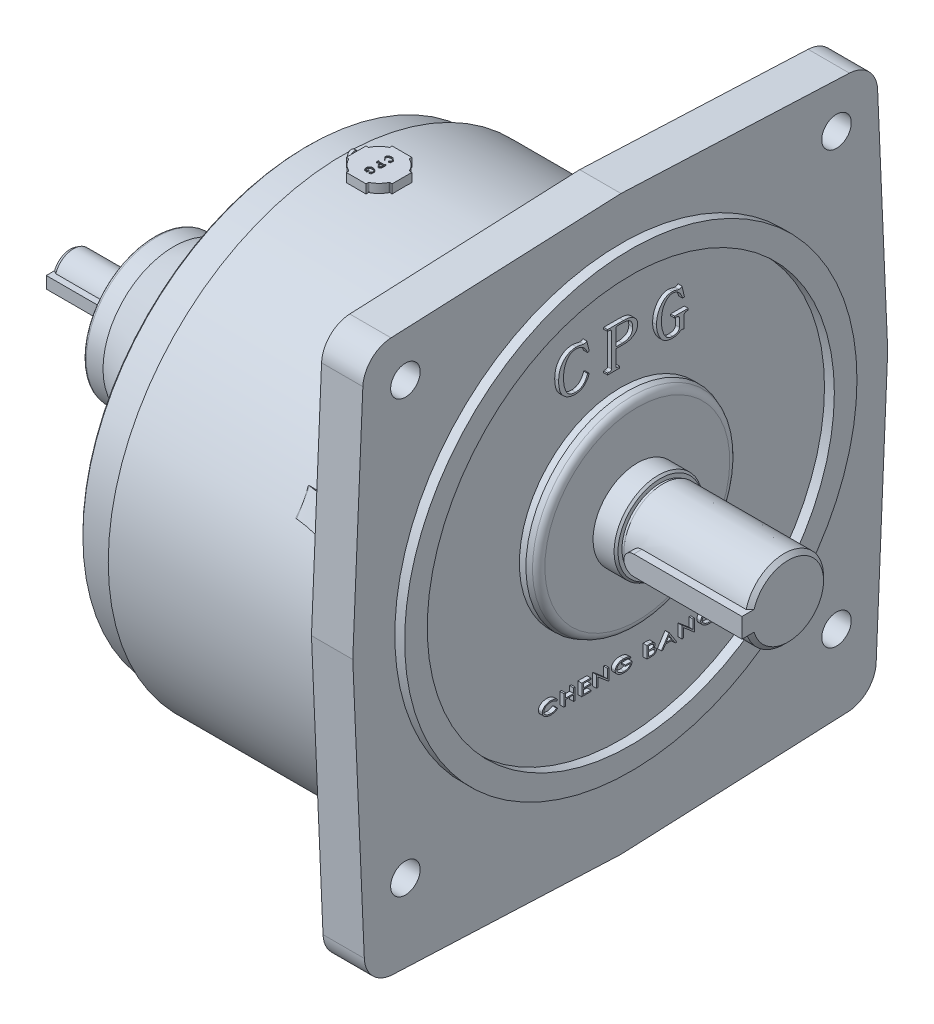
SolidWorks part; units mm, degrees
ref_plane "前基準面" through (0, 0, 0) normal (0, 0, 1) x (1, 0, 0)
ref_plane "上基準面" through (0, 0, 0) normal (0, 1, 0) x (1, 0, 0)
ref_plane "右基準面" through (0, 0, 0) normal (1, 0, 0) x (0, 0, -1)
sketch "草圖1" plane through (0, 0, 0) normal (0, 0, 1) x (1, 0, 0)
  line L0 (-0.0005, 119.7005) -> (-0.0005, 0)
  line L1 (-120, 119.7005) -> (-120, 113.7005)
  line L2 (-120, 119.7005) -> (-0.0005, 119.7005)
  line L3 (-120, 113.7005) -> (-121, 114.7005)
  line L4 (-120, 113.7005) -> (-121, 114.7005)
  line L5 (-120, 119.7005) -> (-120, 113.7005)
  line L6 (-120, 113.7005) -> (-121, 114.7005)
  line L7 (-120, 113.7005) -> (-121, 114.7005)
  line L8 (-141.4941, 95.2005) -> (-141.4941, 90.9581)
  line L9 (-138.9, 113.7005) -> (-138.9, 95.2005)
  line L10 (-138.9, 95.2005) -> (-141.4941, 95.2005)
  line L11 (-137.9, 114.7005) -> (-121, 114.7005)
  line L12 (-137.9, 114.7005) -> (-138.9, 113.7005)
  line L13 (-141.4941, 90.9581) -> (-143.9, 90.9581)
  line L14 (-143.9, 90.9581) -> (-143.9, 80.9505)
  line L15 (-143.9, 80.9505) -> (-145.4538, 80.9505)
  line L16 (-145.4538, 80.9505) -> (-145.4538, 0)
  line L18 (-145.4538, 0) -> (-0.0005, 0)
  line L28 (-430.8849, 0) -> (42.0523, 0) construction
revolve "旋轉1" add sketch "草圖1" angle 360 about L28
sketch "草圖6" plane through (0, 0, 0) normal (0, 0, 1) x (1, 0, 0)
  line L0 (-0.0005, 36) -> (136.2656, 36) construction
  line L1 (149.6, 0) -> (-149.6, 0) construction
  line L2 (106, 36) -> (19.3093, 36)
  line L3 (42.5, 56) -> (104, 56)
  line L4 (41, 57.5) -> (41, 55.5)
  line L5 (42.5, 56) -> (42.5, 55.5)
  line L6 (-0.0005, 119.7005) -> (-0.0005, 0) construction
  line L7 (24.3093, 87.6674) -> (19.3093, 87.6674)
  line L8 (106, 54) -> (106, 36)
  line L9 (29.3093, 83.006) -> (29.3093, 58.5)
  line L10 (40, 58.5) -> (29.3093, 58.5)
  line L11 (104, 56) -> (106, 54)
  line L12 (41, 57.5) -> (40, 58.5)
  line L13 (42.5, 55.5) -> (41, 55.5)
  line L14 (26.7333, 86.7439) -> (24.3093, 87.6674)
  line L16 (19.3093, 87.6674) -> (19.3093, 36)
  arc A5 (29.3093, 83.006) -> (26.7333, 86.7439) centre (25.3093, 83.006) ccw
  point P5 (106, 56)
  dimension "D1" = 36
  dimension "D2" = 65
  dimension "D3" = 40.0001
  dimension "D4" = 45.0001
revolve "旋轉3" add sketch "草圖6" angle 360 about L2
sketch "草圖8" plane through (-0.0005, 0, 0) normal (1, 0, 0) x (0, 0, -1)
  line L1 (0, 173) -> (-116.9067, 167.8957)
  line L2 (-131.2381, 153.5643) -> (-136.3711, 36)
  line L3 (-116.1631, -112.9282) -> (0, -118)
  line L4 (0, -118) -> (115.4194, -112.9607)
  line L5 (-136.3711, 36) -> (-130.4945, -98.5968)
  line L6 (116.1631, 167.9282) -> (0, 173)
  line L7 (130.4945, 153.5968) -> (135.6289, 36)
  line L8 (135.6289, 36) -> (129.7508, -98.6292)
  line L9 (0, 201.9695) -> (0, -167.8269) construction
  line L10 (164.2845, 36) -> (-222.6619, 36) construction
  arc A0 (-116.9067, 167.8957) -> (-131.2381, 153.5643) centre (-116.2524, 152.91) ccw
  arc A1 (130.4945, 153.5968) -> (116.1631, 167.9282) centre (115.5088, 152.9425) ccw
  arc A2 (115.4194, -112.9607) -> (129.7508, -98.6292) centre (114.7651, -97.975) ccw
  arc A3 (-130.4945, -98.5968) -> (-116.1631, -112.9282) centre (-115.5088, -97.9425) ccw
  circle A4 centre (0, 36) radius 155 construction
  circle A5 centre (109.6016, 145.6016) radius 7.5
  circle A6 centre (-109.6, 145.6031) radius 7.5
  circle A7 centre (-109.6016, -73.6016) radius 7.5
  circle A8 centre (109.6016, -73.6016) radius 7.5
  circle A9 centre (0, 36) radius 115 construction
  dimension "D3" = 15
  dimension "D14" = 310
  dimension "D16" = 15
  dimension "D5" = 15
  dimension "D6" = 15
  dimension "D11" = 15
  dimension "D9" = 230
  dimension "D2" = 291
  dimension "D4" = 175
  dimension "D7" = 109.6
  dimension "D13" = 272
ref_plane "平面1" through (0, 36, 0) normal (0, 1, 0) x (-1, 0, 0)
extrude "伸長9" add sketch "草圖8" along normal blind 21
sketch "草圖24"
extrude "伸長12" add sketch "草圖24" along normal blind 2
sketch "草圖25" plane through (0, 0, 0) normal (0, 0, 1) x (1, 0, 0)
  line L1 (-0.0005, 119.7005) -> (-120, 119.7005) construction
  arc A0 (0, 148.7687) -> (-36.9774, 119.7005) centre (-51.9373, 176.7842) cw
rib "肋材4" sketch "草圖25" sketch "草圖25" thickness 13 parameters "D1"=13
pattern_circular "環狀複製排列10" count 6 over 360 about axis through (0, 0, 0) along (1, 0, 0) of "肋材4"
sketch "草圖26" plane through (20.9995, 0, 0) normal (1, 0, 0) x (0, 0, -1)
  circle A0 centre (0, 36) radius 115
  circle A1 centre (0, 36) radius 103.5
  dimension "D1" = 230
  dimension "D2" = 207
extrude "伸長13" add sketch "草圖26" along normal blind 5
sketch "草圖28" plane through (0, 0, 0) normal (0, 0, 1) x (1, 0, 0)
  line L0 (-416.7358, 0) -> (-111.2984, 0) construction
  line L1 (-145.4538, 0) -> (-259, 0)
  line L2 (-145.4538, 79) -> (-159.8655, 79)
  line L4 (106, 18) -> (106, 54) construction
  line L5 (-161.8655, 56.5) -> (-206.3655, 36)
  line L6 (-219.8655, 9.5) -> (-219.8655, 9.45)
  line L7 (-145.4538, 80.9505) -> (-145.4538, -80.9505) construction
  line L8 (-145.4538, 79) -> (-145.4538, 0)
  line L9 (-214.8655, 36) -> (-206.3655, 36)
  line L10 (-161.8655, 77) -> (-161.8655, 56.5)
  line L11 (-219.8655, 9.5) -> (-257.3655, 9.5)
  line L12 (-218.3655, 9.45) -> (-219.8655, 9.45)
  line L13 (-217.8655, 11.25) -> (-218.3655, 10.95)
  line L14 (-259, 0) -> (-259, 8.5)
  line L15 (-259, 8.5) -> (-257.3655, 9.5)
  line L16 (-216.3655, 11.25) -> (-217.8655, 11.25)
  line L19 (-218.3655, 10.95) -> (-218.3655, 9.45)
  line L20 (-216.3655, 11.25) -> (-216.3655, 34.5)
  arc A2 (-214.8655, 36) -> (-216.3655, 34.5) centre (-214.8655, 34.5) ccw
  arc A3 (-159.8655, 79) -> (-161.8655, 77) centre (-159.8655, 77) ccw
  dimension "D6" = 365
  dimension "D1" = 158
  dimension "D2" = 19
  dimension "D3" = 36
  dimension "D4" = 72
revolve "旋轉4" add sketch "草圖28" angle 360 about L0
sketch "草圖31" plane through (0, 0, 0) normal (0, 0, 1) x (1, 0, 0)
  line L0 (155.3486, 36) -> (-7.3521, 36) construction
  line L1 (106, 41) -> (51, 41)
  line L2 (106, 18) -> (106, 54) construction
  line L3 (51, 31) -> (106, 31)
  line L4 (106, 31) -> (106, 41)
  line L5 (46, 36) -> (46, 76.3019) construction
  line L6 (149.5, 36) -> (149.5, 71.6265) construction
  arc A0 (51, 41) -> (51, 31) centre (51, 36) ccw
  dimension "D1" = 20
  dimension "D2" = 10
  dimension "D3" = 5
  dimension "D4" = 60
  dimension "D5" = 43.5
extrude "伸長15" add sketch "草圖31" along normal blind 23.5
sketch "草圖32" plane through (0, 0, 0) normal (0, 0, 1) x (1, 0, 0)
  line L0 (-287.4113, 0) -> (-204.4443, 0) construction
  line L1 (-259, 3) -> (-227, 3)
  line L2 (-259, 8.5) -> (-259, -8.5) construction
  line L3 (-227, -3) -> (-259, -3)
  line L4 (-259, -3) -> (-259, 3)
  line L5 (-224, 0) -> (-224, 13.4318) construction
  line L6 (-280.7, 0) -> (-280.7, 16.0598) construction
  arc A0 (-227, 3) -> (-227, -3) centre (-227, 0) cw
  dimension "D1" = 9.5
  dimension "D2" = 6
  dimension "D3" = 3
  dimension "D4" = 35
  dimension "D5" = 21.7
extrude "伸長16" add sketch "草圖32" along normal blind 12.2
ref_plane "平面2" through (0, 124.1, 0) normal (0, 1, 0) x (-1, 0, 0)
sketch "草圖33" plane through (0, 124.1, 0) normal (0, 1, 0) x (-1, 0, 0)
  line L0 (97, 11.65) -> (107, 11.65)
  line L1 (97, 11.65) -> (97, 10.5119)
  line L2 (107, 11.65) -> (107, 10.5119)
  line L3 (97, -10.5119) -> (97, -11.65)
  line L4 (107, -10.5119) -> (107, -11.65)
  line L5 (90.35, 5) -> (91.4881, 5)
  line L6 (90.35, -5) -> (91.4881, -5)
  line L7 (90.35, -5) -> (90.35, 5)
  line L8 (97, -11.65) -> (97, -10.5119)
  line L9 (107, -11.65) -> (107, -10.5119)
  line L10 (107, -11.65) -> (97, -11.65)
  line L11 (113.65, -5) -> (112.5119, -5)
  line L12 (113.65, 5) -> (112.5119, 5)
  line L13 (113.65, 5) -> (113.65, -5)
  arc A0 (96.8617, 10.2882) -> (91.7118, 5.1383) centre (102, 0) ccw
  arc A1 (96.8617, 10.2882) -> (97, 10.5119) centre (96.75, 10.5119) ccw
  arc A2 (107, 10.5119) -> (107.1383, 10.2882) centre (107.25, 10.5119) ccw
  arc A3 (91.4881, 5) -> (91.7118, 5.1383) centre (91.4881, 5.25) ccw
  arc A4 (91.7118, -5.1383) -> (91.4881, -5) centre (91.4881, -5.25) ccw
  arc A5 (97, -10.5119) -> (96.8617, -10.2882) centre (96.75, -10.5119) ccw
  arc A6 (107.1383, -10.2882) -> (107, -10.5119) centre (107.25, -10.5119) ccw
  arc A7 (112.5119, -5) -> (112.2882, -5.1383) centre (112.5119, -5.25) ccw
  arc A8 (112.2882, 5.1383) -> (112.5119, 5) centre (112.5119, 5.25) ccw
  arc A9 (112.2882, 5.1383) -> (107.1383, 10.2882) centre (102, 0) ccw
  arc A10 (91.7118, -5.1383) -> (96.8617, -10.2882) centre (102, 0) ccw
  arc A11 (107.1383, -10.2882) -> (112.2882, -5.1383) centre (102, 0) ccw
extrude "伸長17" add sketch "草圖33" against normal blind 4.5 contours A6 A11 A7 L11 L13 L12 A8 A9 A2 L2 L0 L1 A1 A0 A3 L5 L7 L6 A4 A10 A5 L3 L10 L4
sketch "草圖34"
extrude "伸長18" add sketch "草圖34" along normal blind 0.5
sketch "草圖35" plane through (0, 0, 0) normal (0, 0, 1) x (1, 0, 0)
  line L0 (-116.0418, 121.95) -> (-108.0418, 121.95)
  line L1 (-116.0418, 121.95) -> (-116.0418, 123.95)
  line L2 (-114.5418, 123.2) -> (-114.5418, 123.95)
  line L13 (-112.5418, 123.2) -> (-108.0418, 122.95)
  line L15 (-114.5418, 123.2) -> (-112.5418, 123.2)
  line L23 (-116.0418, 123.95) -> (-114.5418, 123.95)
  line L24 (-112.5418, 121.95) -> (-112.5418, 123.2)
  line L25 (-108.0418, 121.95) -> (-108.0418, 122.95)
revolve "旋轉5" add sketch "草圖35" angle 360 about L0
equation "\"D4@草圖6\" = \"D3@草圖6\"+5"
equation "\"D1@伸長15\" = \"D5@草圖31\"-\"D3@草圖6\"/2"
equation "\"D1@草圖26\" = \"D2@草圖26\"+23"
equation "\"D1@伸長16\" = \"D5@草圖32\"-\"D2@草圖28\"/2"
